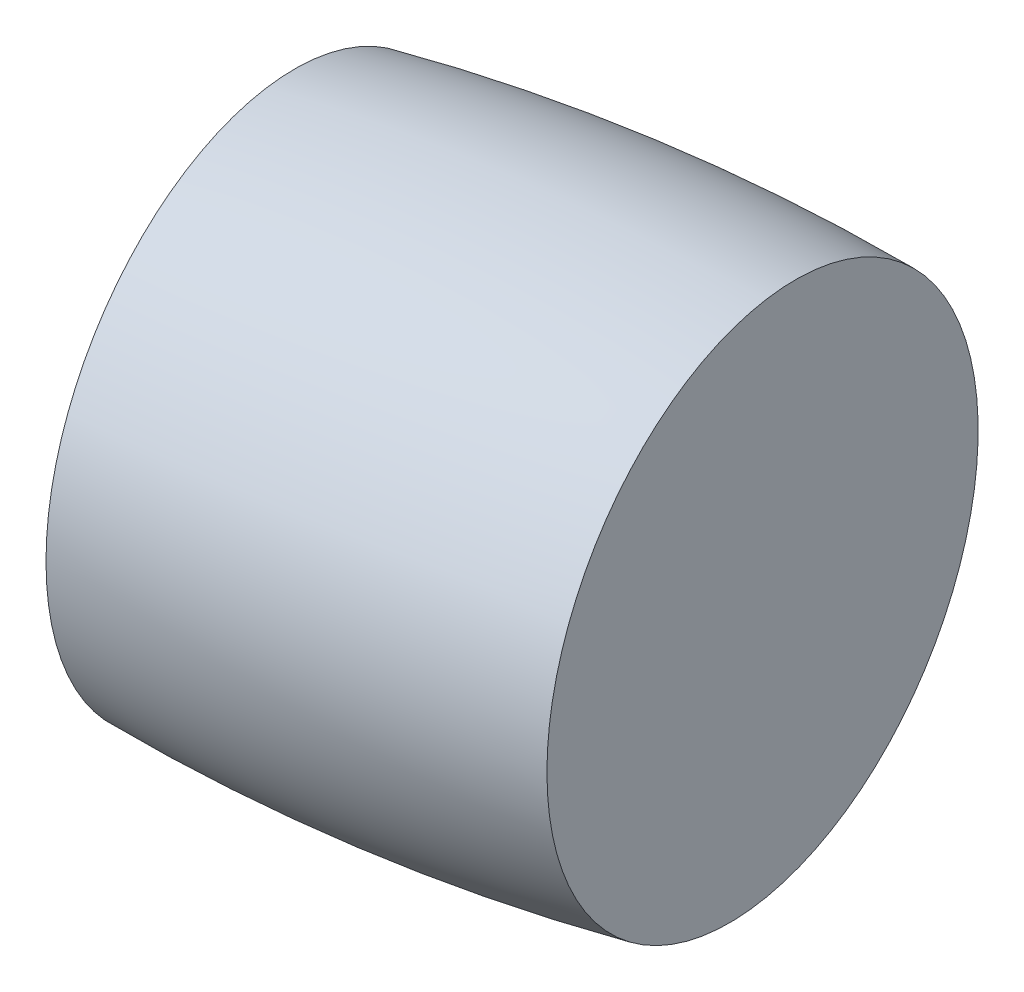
SolidWorks part; units mm, degrees
ref_plane "Plan1" through (0, 0, 0) normal (0, 0, 1) x (1, 0, 0)
ref_plane "Plan2" through (0, 0, 0) normal (0, 1, 0) x (1, 0, 0)
ref_plane "Plan3" through (0, 0, 0) normal (1, 0, 0) x (0, 0, -1)
sketch "Esquisse1" plane through (0, 0, 0) normal (0, 1, 0) x (1, 0, 0)
  line L2 (0, 0) -> (10, 1.5713) construction
  line L3 (-6.8677, -11.2925) -> (-10, 8.6421) construction
  line L7 (10, -8.6421) -> (6.8677, 11.2925) construction
  line L8 (-8.4339, -1.3252) -> (10, 1.5713) construction
  line L9 (-8.4339, -1.3252) -> (-10, 8.6421)
  line L10 (8.4339, 1.3252) -> (6.8677, 11.2925)
  line L11 (-8.4339, -1.3252) -> (8.4339, 1.3252)
  arc A0 (30, 8.6421) -> (-10, 8.6421) centre (10, -63.6421) ccw construction
  arc A1 (6.8677, 11.2925) -> (-10, 8.6421) centre (10, -63.6421) ccw
revolve "Base-Révolution" add sketch "Esquisse1" angle 360 about L8
